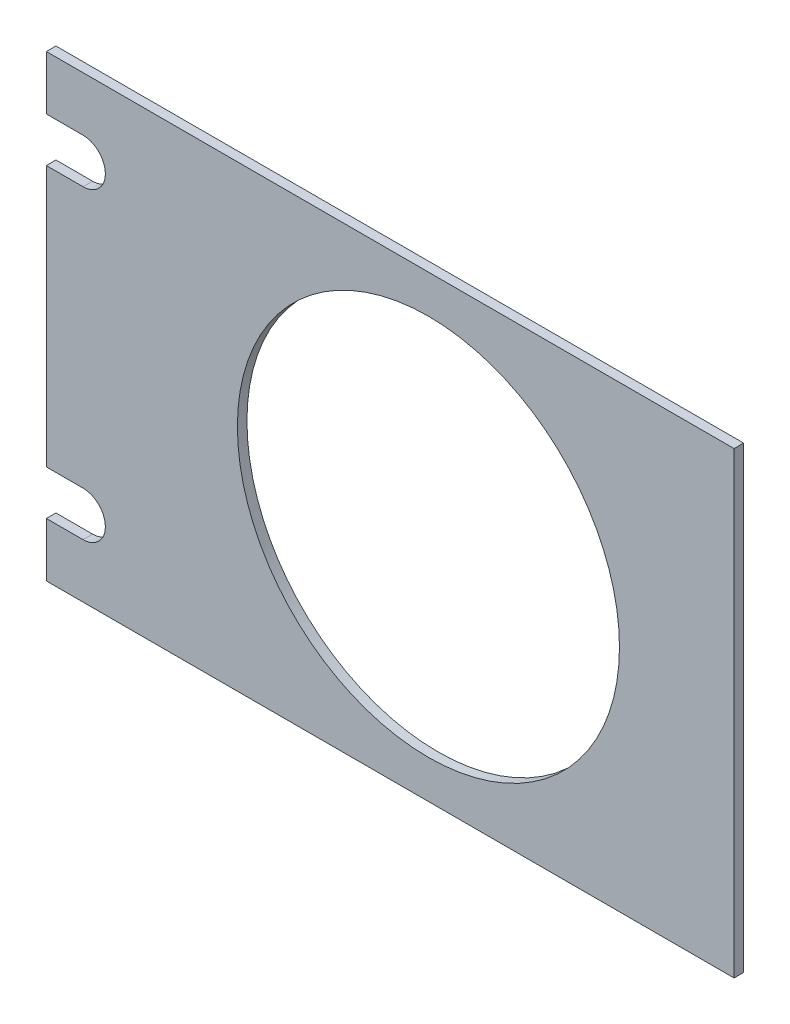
SolidWorks part; units mm, degrees
ref_plane "Front" through (0, 0, 0) normal (0, 0, 1) x (1, 0, 0)
ref_plane "Top" through (0, 0, 0) normal (0, 1, 0) x (1, 0, 0)
ref_plane "Right" through (0, 0, 0) normal (1, 0, 0) x (0, 0, -1)
sketch "Sketch1" plane through (0, 0, 0) normal (0, 0, 1) x (1, 0, 0)
  line L0 (0, 0) -> (3.8159, 0) construction
  line L1 (0, -9.525) -> (28.575, -9.525)
  line L2 (0, -9.525) -> (0, -7.2771)
  line L3 (0, 9.525) -> (28.575, 9.525)
  line L4 (28.575, -9.525) -> (28.575, 9.525)
  line L5 (0, 7.2771) -> (0, 9.525)
  line L6 (0, 7.2771) -> (1.524, 7.2771)
  line L7 (0, -5.4229) -> (1.524, -5.4229)
  line L8 (0, 5.4229) -> (1.524, 5.4229)
  line L9 (0, -7.2771) -> (1.524, -7.2771)
  line L10 (0, -5.4229) -> (0, 5.4229)
  circle A0 centre (15.875, 0) radius 7.9375
  arc A1 (1.524, 5.4229) -> (1.524, 7.2771) centre (1.524, 6.35) ccw
  arc A2 (1.524, -5.4229) -> (1.524, -7.2771) centre (1.524, -6.35) cw
  dimension "D4" = 15.875
  dimension "D5" = 1.8542
  dimension "D1" = 28.575
  dimension "D2" = 19.05
  dimension "D3" = 15.875
  dimension "D6" = 6.35
  dimension "D7" = 9.525
  dimension "D8" = 1.524
extrude "Extrude1" add sketch "Sketch1" along normal mid plane 0.3969
equation "\"D7@Sketch1\" = \"D2@Sketch1\"/2"
